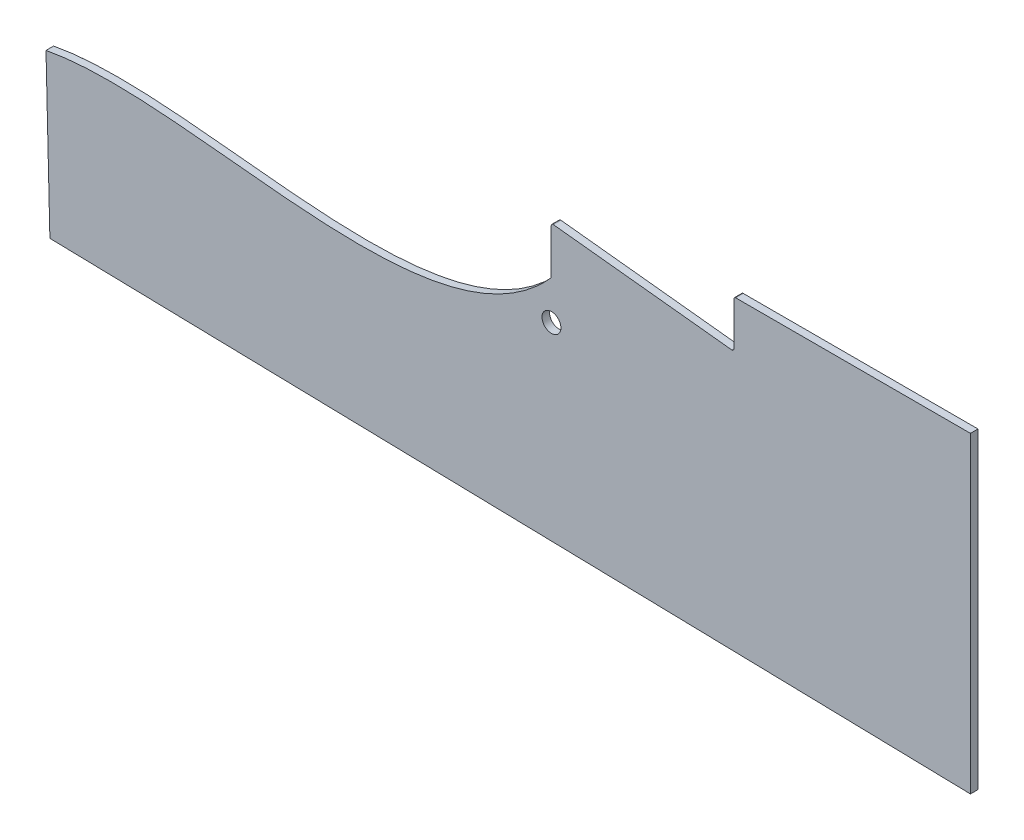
SolidWorks part; units mm, degrees
ref_plane "Płaszczyzna przednia" through (0, 0, 0) normal (0, 0, 1) x (1, 0, 0)
ref_plane "Płaszczyzna górna" through (0, 0, 0) normal (0, 1, 0) x (1, 0, 0)
ref_plane "Płaszczyzna prawa" through (0, 0, 0) normal (1, 0, 0) x (0, 0, -1)
sketch "Szkic1" plane through (0, 0, 0) normal (0, 0, 1) x (1, 0, 0)
  line L0 (0, 170.2745) -> (0, 145.2745)
  line L1 (221.4561, 19.8216) -> (221.4561, 184.8216)
  line L2 (96.4561, 159.8216) -> (0, 170.2745)
  line L4 (96.4561, 159.8216) -> (96.4561, 184.8216)
  line L5 (96.4561, 184.8216) -> (221.4561, 184.8216)
  line L9 (-266.9192, 115.837) -> (-264.8632, 30.8619)
  line L10 (-264.8632, 30.8619) -> (221.4561, 19.8216)
  spline S0 degree 3 poles (-266.9192, 115.837) (-187.4238, 131.052) (-61.0569, 76.8968) (0, 145.2745) knots 0 0 0 0 1 1 1 1
  dimension "D5" = 125
  dimension "D2" = 85
  dimension "D4" = 25
  dimension "D6" = 25
  dimension "D7" = 165
extrude "Dodanie-wyciągnięcie1" add sketch "Szkic1" along normal blind 4 contours L10 L1 L5 L4 L2 L0 S0 L9
sketch "Szkic2" plane through (0, 0, 4) normal (0, 0, 1) x (1, 0, 0)
  line L1 (-264.8632, 30.8619) -> (221.4561, 19.8216) construction
  circle A0 centre (0.1147, 124.8722) radius 5
  dimension "D1" = 100
extrude "Wytnij-wyciągnięcie4" cut sketch "Szkic2" against normal blind 10 contours A0
fillet "Zaokrąglenie1" radius 1 4 edges at (96.4561, 184.8216, 2) (96.4561, 159.8216, 2) (0, 170.2745, 2) (0, 145.2745, 2)
sketch "Szkic3" plane through (0, 0, 4) normal (0, 0, 1) x (1, 0, 0)
  spline S0 degree 3 number of poles 108 (-266.9192, 115.837) -> (221.4561, 184.8216)
surface "Powierzchnia-Wyciągnięcie1" sketch "Szkic3"
